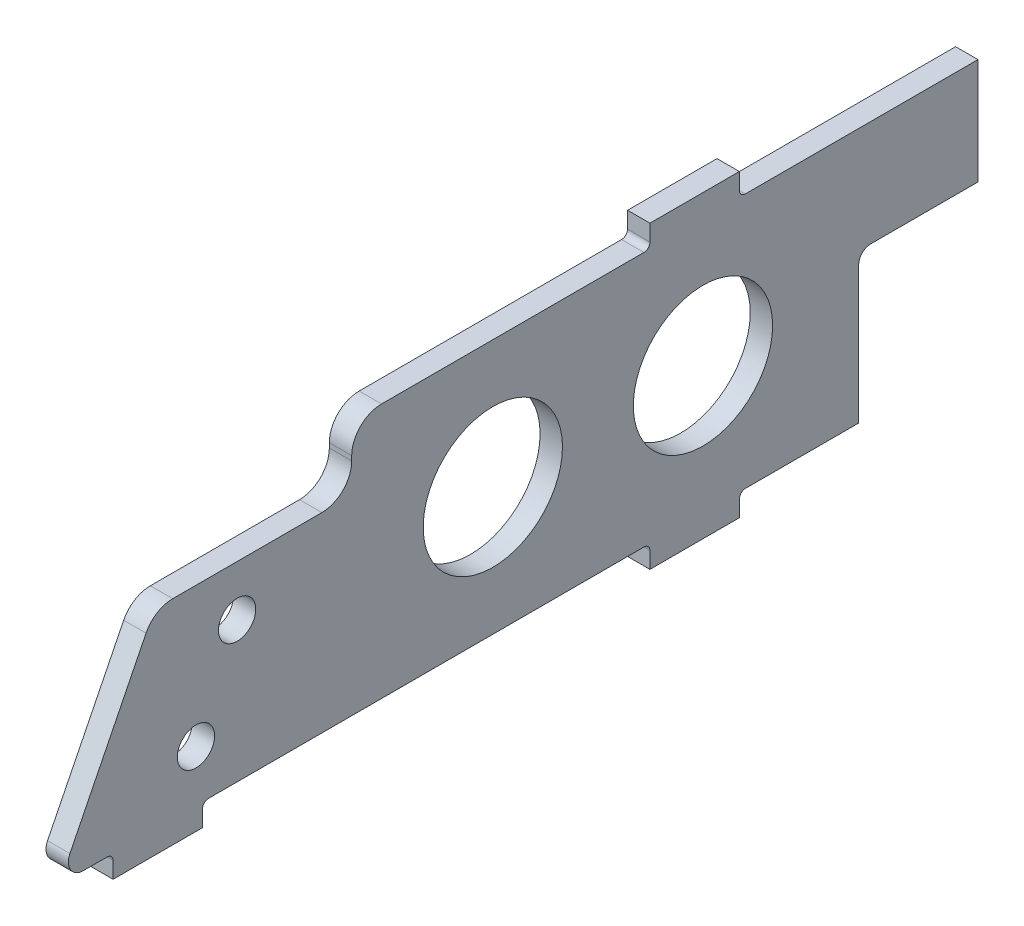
SolidWorks part; units mm, degrees
ref_plane "Front Plane" through (0, 0, 0) normal (0, 0, 1) x (1, 0, 0)
ref_plane "Top Plane" through (0, 0, 0) normal (0, 1, 0) x (1, 0, 0)
ref_plane "Right Plane" through (0, 0, 0) normal (1, 0, 0) x (0, 0, -1)
sketch "Sketch1" plane through (0, 0, 0) normal (0, 0, 1) x (1, 0, 0)
  line L0 (-6.604, 183.4966) -> (-6.604, 262.7446)
  line L2 (0, 329.9063) -> (0, 108.3703) construction
  line L3 (-11.3665, 262.7446) -> (-11.3665, 183.4966)
  line L4 (-11.3665, 262.7446) -> (-6.604, 262.7446)
  line L5 (-11.3665, 183.4966) -> (-6.604, 183.4966)
  line L6 (-23.5926, 196.1966) -> (23.1662, 196.1966) construction
  line L8 (-6.9736, 189.5416) -> (5.7264, 189.5416) construction
  line L10 (5.7264, 202.8516) -> (-6.9736, 202.8516) construction
  line L11 (5.7264, 202.8516) -> (-6.9736, 202.8516) construction
  line L12 (-6.9736, 189.5416) -> (5.7264, 189.5416) construction
  arc A0 (76.2, 248.285) -> (-76.2, 248.285) centre (0, 0) ccw construction
  dimension "D1" = 13.208
  dimension "D2" = 4.7625
  dimension "D3" = 79.248
  dimension "D4" = 12.7
extrude "Extrude1" add sketch "Sketch1" along normal up to surface (266.0266 mm away)
sketch "Sketch2" plane through (-6.604, 0, 0) normal (1, 0, 0) x (0, 0, -1)
  line L0 (0, 183.4966) -> (0, 262.7446) construction
  line L1 (0, 215.2466) -> (-22.86, 215.2466)
  line L2 (0, 215.2466) -> (0, 183.4966)
  line L3 (-127, 237.8135) -> (6.35, 237.8135)
  line L4 (0, 183.4966) -> (-25.4, 183.4966)
  line L5 (-25.4, 212.7066) -> (-25.4, 183.4966)
  line L6 (-177.1336, 220.6184) -> (-193.3418, 188.0875)
  line L7 (-171.45, 224.1366) -> (-139.7, 224.1366)
  line L8 (-266.0266, 183.4966) -> (0, 183.4966) construction
  line L9 (-284.4465, 183.4966) -> (-190.5, 183.4966)
  line L10 (6.35, 259.715) -> (6.35, -259.715) construction
  line L11 (-284.4465, 183.4966) -> (-284.4465, 274.0543)
  line L12 (-284.4465, 274.0543) -> (-12.4871, 274.0543)
  line L13 (-133.35, 230.4866) -> (-133.35, 231.4635)
  line L14 (6.35, 237.8135) -> (6.35, 259.715)
  line L15 (6.35, 259.715) -> (6.35, 274.0543)
  line L16 (6.35, 274.0543) -> (-12.4871, 274.0543)
  arc A0 (-25.4, 212.7066) -> (-22.86, 215.2466) centre (-22.86, 212.7066) cw
  arc A1 (-127, 237.8135) -> (-133.35, 231.4635) centre (-127, 231.4635) ccw
  arc A2 (-193.3418, 188.0875) -> (-190.5, 183.4966) centre (-190.5, 186.6716) ccw
  arc A3 (-133.35, 230.4866) -> (-139.7, 224.1366) centre (-139.7, 230.4866) cw
  arc A4 (-171.45, 224.1366) -> (-177.1336, 220.6184) centre (-171.45, 217.7866) ccw
  point P20 (-25.4, 215.2466)
  dimension "D1" = 6.35
  dimension "D4" = 2.54
  dimension "D5" = 6.35
  dimension "D8" = 19.05
  dimension "D9" = 190.5
  dimension "D10" = 6.35
  dimension "D2" = 31.75
  dimension "D3" = 25.4
  dimension "D6" = 133.35
  dimension "D7" = 40.64
extrude "Cut-Extrude1" cut sketch "Sketch2" against normal through all
sketch "Sketch3" plane through (-6.604, 0, 0) normal (1, 0, 0) x (0, 0, -1)
  line L0 (-190.5, 183.4966) -> (-25.4, 183.4966) construction
  line L1 (-69.85, 183.4966) -> (-50.8, 183.4966)
  line L2 (-69.85, 183.4966) -> (-69.85, 178.7341)
  line L3 (-69.85, 178.7341) -> (-50.8, 178.7341)
  line L4 (-50.8, 183.4966) -> (-50.8, 178.7341)
  line L5 (0, 215.2466) -> (0, 237.8135) construction
  line L6 (-165.1, 183.4966) -> (-184.15, 183.4966)
  line L7 (-165.1, 183.4966) -> (-165.1, 178.7341)
  line L8 (-165.1, 178.7341) -> (-184.15, 178.7341)
  line L9 (-184.15, 183.4966) -> (-184.15, 178.7341)
  line L10 (-127, 237.8135) -> (0, 237.8135) construction
  line L11 (-69.85, 242.576) -> (-50.8, 242.576)
  line L12 (-69.85, 242.576) -> (-69.85, 237.8135)
  line L13 (-69.85, 237.8135) -> (-50.8, 237.8135)
  line L14 (-50.8, 242.576) -> (-50.8, 237.8135)
  dimension "D1" = 4.7625
  dimension "D2" = 19.05
  dimension "D3" = 50.8
  dimension "D4" = 114.3
extrude "Extrude2" add sketch "Sketch3" against normal blind 4.7625
fillet "Fillet1" [suppressed] radius 1.27
hole_wizard "5/16 (0.3125) Diameter Hole1" positions "Sketch5" profile "Sketch4" hole size "5/16" standard "Ansi Inch"
sketch "Sketch5" plane through (-6.604, 0, 0) normal (1, 0, 0) x (0, 0, -1)
  point P1 (-157.7471, 213.3924)
  point P4 (-166.5101, 194.4186)
sketch "Sketch4" plane through (-6.604, 213.3924, 157.7471) normal (0, 1, 0) x (0, 0, -1)
  line L0 (0, 0) -> (0, 4.7625)
  line L1 (0, 4.7625) -> (3.9687, 4.7625)
  line L2 (3.9687, 4.7625) -> (3.9688, 0)
  line L5 (3.9688, 0) -> (0, 0)
  line L11 (0, -6.35) -> (0, 107.95) construction
  dimension "Thru Hole Dia." = 7.9375
  dimension "Thru Hole Depth" = 4.7625
sketch "Sketch6" plane through (-6.604, 0, 0) normal (1, 0, 0) x (0, 0, -1)
  line L0 (17.6073, 210.6551) -> (-275.606, 210.6551) construction
  line L1 (-127, 237.8135) -> (-69.85, 237.8135) construction
  line L2 (-166.37, 183.4966) -> (-68.58, 183.4966) construction
  line L3 (-275.606, 203.8166) -> (-171.4767, 203.8166) construction
  line L4 (-171.45, 224.1366) -> (-139.7, 224.1366) construction
  line L5 (-190.5, 183.4966) -> (-184.15, 183.4966) construction
  circle A0 centre (-103.2999, 210.6551) radius 14.8276
  circle A1 centre (-58.5589, 210.6551) radius 14.8276
extrude "Cut-Extrude2" cut sketch "Sketch6" against normal through all
fillet "Fillet3" radius 1.27 6 edges at (-8.9852, 183.4966, 69.85) (-8.9852, 183.4966, 50.8) (-8.9852, 183.4966, 165.1) (-8.9852, 183.4966, 184.15) (-8.9852, 237.8135, 50.8) (-8.9852, 237.8135, 69.85)
